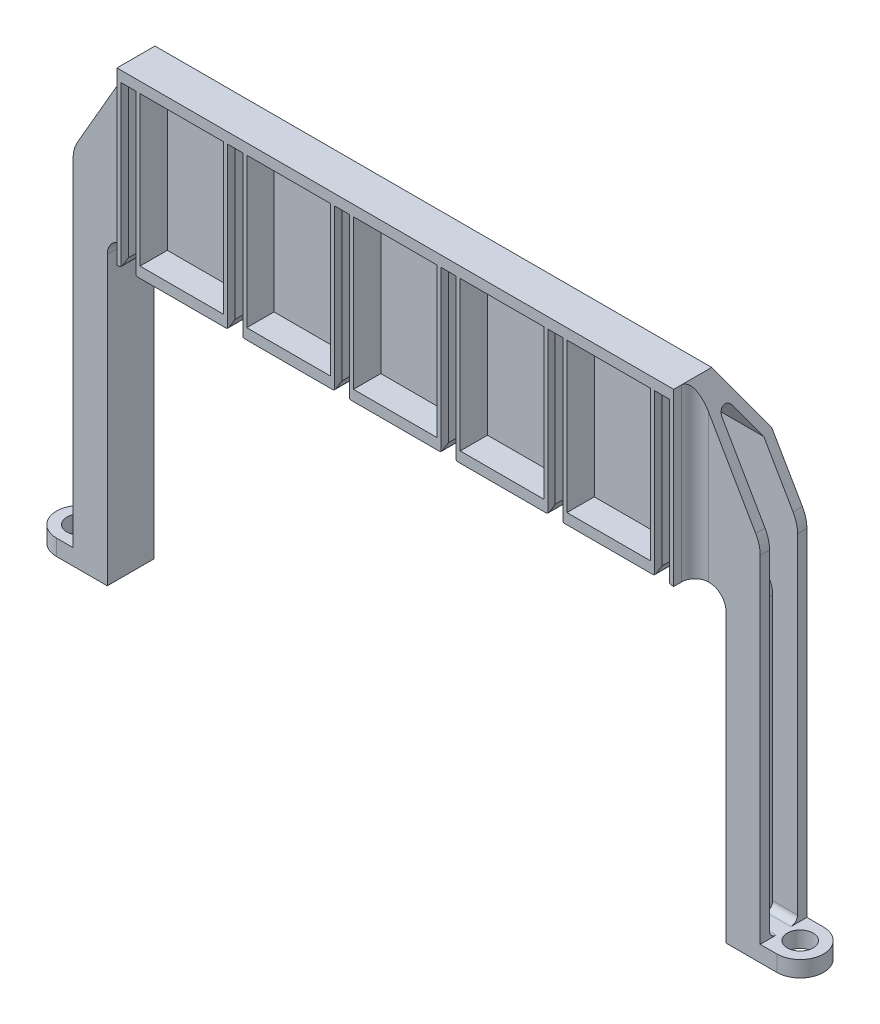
SolidWorks part; units mm, degrees
ref_plane "Front Plane" through (0, 0, 0) normal (0, 0, 1) x (1, 0, 0)
ref_plane "Top Plane" through (0, 0, 0) normal (0, 1, 0) x (1, 0, 0)
ref_plane "Right Plane" through (0, 0, 0) normal (1, 0, 0) x (0, 0, -1)
sketch "Sketch1" plane through (0, 0, 0) normal (0, 1, 0) x (1, 0, 0)
  line L0 (-0.9207, 0) -> (0.9207, 0)
  line L1 (-0.9207, 0) -> (-0.9207, -2.54)
  line L2 (-2.1907, -3.4199) -> (-1.4287, -3.4199)
  line L3 (-2.1907, -3.4199) -> (-2.1908, 3.81)
  line L4 (-2.1908, 3.81) -> (2.1907, 3.81)
  line L5 (0.9207, 0) -> (0.9208, -2.54)
  line L6 (0, 0) -> (0, -8.1054) construction
  line L7 (-1.4287, -3.4199) -> (-0.9207, -2.54)
  line L8 (2.1907, -3.4199) -> (2.1907, 3.81)
  line L9 (2.1907, -3.4199) -> (1.4287, -3.4199)
  line L10 (1.4287, -3.4199) -> (0.9208, -2.54)
  dimension "D1" = 1.8415
  dimension "D2" = 3.81
  dimension "D3" = 2.54
  dimension "D4" = 60
  dimension "D5" = 0.762
  dimension "D6" = 1.27
extrude "Boss-Extrude1" add sketch "Sketch1" against normal blind 30.48
chamfer "Chamfer1" distance 0.508 angle 70 2 edges at (-0.9207, -30.48, 1.27) (0.9208, -30.48, 1.27)
fillet "Fillet4" radius 0.508 3 edges at (1.4288, -30.48, 1.7099) (-1.4288, -30.48, 1.7099) (0, -30.48, 0)
pattern_linear "LPattern3" count 6 spacing 20.32 along (-1, 0, 0)
ref_plane "Plane2" through (-50.8, 0, 0) normal (-1, 0, 0) x (0, 0, 1)
sketch "Sketch3" plane through (0, 0, 0) normal (0, 1, 0) x (1, 0, 0)
  line L1 (2.1907, 3.81) -> (-103.7908, 3.81)
  line L2 (2.1907, 3.81) -> (2.1907, -3.4199)
  line L3 (2.1907, -3.4199) -> (-103.7908, -3.4199)
  line L4 (-103.7908, 3.81) -> (-103.7908, -3.4199)
extrude "Boss-Extrude3" add sketch "Sketch3" along normal blind 2.032
ref_plane "Plane4" through (0, -4.318, 0) normal (0, 1, 0) x (1, 0, 0)
sketch "Sketch7" plane through (0, 2.032, 0) normal (0, 1, 0) x (1, 0, 0)
  line L0 (-2.1908, 3.81) -> (-2.1907, -3.4199) construction
  line L1 (-2.1908, 9.525) -> (17.778, 9.525)
  line L2 (17.778, 0.635) -> (2.1907, 0.635)
  line L3 (25.398, -172.7825) -> (25.398, 30.4175) construction
  line L4 (2.1907, 3.81) -> (-103.7908, 3.81) construction
  line L5 (-2.1908, 9.525) -> (-2.1907, 3.81)
  line L6 (-2.1907, 3.81) -> (2.1907, 3.81)
  line L7 (2.1907, 3.81) -> (2.1907, 0.635)
  line L11 (2.1907, -3.4199) -> (2.1907, 3.81) construction
  arc A1 (17.778, 9.525) -> (17.778, 0.635) centre (17.778, 5.08) cw
  dimension "D2" = 7.62
  dimension "D1" = 4.445
  dimension "D3" = 1.27
extrude "Boss-Extrude6" add sketch "Sketch7" against normal up to surface (90.372 mm away)
sketch "Sketch34" plane through (0, 0, -9.525) normal (0, 0, -1) x (-1, 0, 0)
  line L1 (2.1908, -30.48) -> (-4.9213, -30.48)
  line L2 (-8.0963, -33.655) -> (-8.0962, -88.34)
  line L3 (-17.778, -88.34) -> (2.1908, -88.34) construction
  line L4 (-8.0962, -88.34) -> (2.1908, -88.34)
  line L5 (2.1908, -88.34) -> (2.1908, -30.48)
  line L6 (-2.1908, 2.032) -> (-14.603, -19.4666)
  line L10 (-14.603, -19.4666) -> (-14.603, -85.292)
  line L11 (-2.1907, -30.48) -> (2.1907, -30.48) construction
  line L12 (-17.778, 2.032) -> (2.1908, 2.032) construction
  line L13 (-14.603, -85.292) -> (-22.223, -85.292)
  line L15 (-22.223, -85.292) -> (-22.223, 2.032)
  line L18 (-22.223, 2.032) -> (-2.1908, 2.032)
  line L19 (-22.223, 2.032) -> (-22.223, -88.34) construction
  line L20 (-17.778, -88.34) -> (2.1908, -88.34) construction
  arc A0 (-8.0963, -33.655) -> (-4.9213, -30.48) centre (-4.9213, -33.655) cw
  point P5 (-9.2392, -30.48)
  dimension "D2" = 7.62
  dimension "D1" = 3.175
  dimension "D4" = 60
  dimension "D5" = 3.048
  dimension "D7" = 7.112
extrude "Cut-Extrude14" cut sketch "Sketch34" against normal up to surface (8.89 mm away)
sketch "Sketch35" plane through (-2.1907, 0, 0) normal (-1, 0, 0) x (0, 0, 1)
  line L0 (-3.81, 2.032) -> (-9.525, -7.8667)
  line L1 (-9.525, -30.48) -> (-9.525, 2.032) construction
  line L2 (-9.525, -7.8667) -> (-9.525, 2.032)
  line L3 (-9.525, 2.032) -> (-3.81, 2.032)
  dimension "D1" = 60
extrude "Cut-Extrude18" cut sketch "Sketch35" against normal through all
sketch "Sketch36" plane through (0, 2.032, 0) normal (0, 1, 0) x (1, 0, 0)
  line L1 (-0.4128, 7.747) -> (29.1222, 7.747)
  line L2 (-0.4128, 7.747) -> (-0.4128, 2.413)
  line L3 (-0.4128, 2.413) -> (29.1222, 2.413)
  line L4 (29.1222, 7.747) -> (29.1222, 2.413)
  line L5 (22.223, 5.08) -> (-0.4128, 5.08) construction
  line L6 (7.9058, 9.525) -> (-2.1908, 9.525) construction
  line L7 (-2.1908, 9.525) -> (-2.1908, 3.81) construction
  arc A0 (17.778, 0.635) -> (17.778, 9.525) centre (17.778, 5.08) ccw construction
  dimension "D1" = 1.778
  dimension "D2" = 1.778
extrude "Cut-Extrude19" cut sketch "Sketch36" against normal up to surface (87.324 mm away)
sketch "Sketch37" plane through (0, 0, -7.747) normal (0, 0, 1) x (1, 0, 0)
  line L11 (-2.1907, -28.702) -> (4.9213, -28.702)
  line L12 (9.8742, -33.655) -> (9.8743, -88.3029)
  line L13 (-2.1907, -30.48) -> (4.9213, -30.48)
  line L14 (8.0962, -33.655) -> (8.0962, -88.34)
  line L15 (-2.1907, -30.48) -> (4.9213, -30.48)
  line L16 (8.0962, -33.655) -> (8.0962, -88.34)
  line L17 (-2.1907, -30.48) -> (-2.1907, -28.702)
  line L18 (8.0962, -88.34) -> (11.0176, -88.34)
  line L19 (25.398, -88.34) -> (-127.002, -88.34) construction
  line L20 (11.0176, -88.34) -> (9.8743, -88.3029)
  arc A3 (9.8742, -33.655) -> (4.9213, -28.702) centre (4.9213, -33.655) ccw
  arc A4 (8.0962, -33.655) -> (4.9213, -30.48) centre (4.9213, -33.655) ccw
  arc A5 (8.0962, -33.655) -> (4.9213, -30.48) centre (4.9213, -33.655) ccw
  dimension "D4" = 1.778
  dimension "D2" = 1.778
  dimension "D3" = 1.778
  dimension "D1" = 0
extrude "Boss-Extrude7" add sketch "Sketch37" along normal up to surface (5.334 mm away)
sketch "Sketch39" plane through (-0.4128, 0, 0) normal (-1, 0, 0) x (0, 0, 1)
  line L0 (-2.413, 2.032) -> (-2.413, 0.8957)
  line L1 (-2.413, -28.702) -> (-2.413, 2.032) construction
  line L2 (-2.413, 0.8957) -> (-7.747, -8.3431)
  line L3 (-7.747, -28.702) -> (-7.747, -4.7871) construction
  line L4 (-7.747, -8.3431) -> (-7.747, -4.7871)
  line L5 (-2.413, -28.702) -> (-2.413, 2.032) construction
  line L6 (-2.413, 2.032) -> (-3.81, 2.032)
  line L7 (-3.81, 2.032) -> (-7.747, -4.7871)
  dimension "D1" = 1.778
extrude "Boss-Extrude9" add sketch "Sketch39" against normal up to surface (3.2596 mm away)
hole_wizard "#10 (0.1935) Diameter Hole1" positions "Sketch41" profile "Sketch40" hole size "#10" standard "ANSI Inch"
sketch "Sketch41" plane through (0, -85.292, 0) normal (0, 1, 0) x (1, 0, 0)
  arc A0 (17.778, 0.635) -> (17.778, 9.525) centre (17.778, 5.08) ccw construction
  point P0 (17.778, 5.08)
sketch "Sketch40" plane through (17.778, -85.292, -5.08) normal (1, 0, 0) x (0, 0, 1)
  line L0 (0, 0) -> (0, 3.048)
  line L1 (0, 3.048) -> (2.4574, 3.048)
  line L2 (2.4574, 3.048) -> (2.4574, 0)
  line L5 (2.4574, 0) -> (0, 0)
  line L11 (0, -6.35) -> (0, 107.95) construction
  dimension "Thru Hole Dia." = 4.9149
  dimension "Thru Hole Depth" = 3.048
mirror "Mirror1" about plane through (-50.8, 0, 0) normal (-1, 0, 0) of "#10 (0.1935) Diameter Hole1", "Boss-Extrude9", "Boss-Extrude7", "Cut-Extrude19", "Cut-Extrude18", "Cut-Extrude14", "Boss-Extrude6"
sketch "Sketch43" plane through (0, -30.48, 0) normal (0, -1, 0) x (1, 0, 0)
  line L0 (-63.1508, -3.81) -> (-79.0892, -3.81) construction
  line L1 (-18.1292, 3.4199) -> (-2.1908, 3.4199)
  line L2 (-18.1292, 3.4199) -> (-18.1293, -3.81)
  line L3 (-18.1293, -3.81) -> (-2.1907, -9.525)
  line L4 (-2.1908, 3.4199) -> (-2.1907, -9.525)
  line L5 (-38.4493, 3.4199) -> (-22.5108, 3.4199)
  line L6 (-38.4493, 3.4199) -> (-38.4493, -3.81)
  line L7 (-38.4493, -3.81) -> (-22.5108, -3.81)
  line L8 (-22.5108, 3.4199) -> (-22.5108, -3.81)
  line L9 (-58.7692, 3.4199) -> (-42.8308, 3.4199)
  line L10 (-58.7692, 3.4199) -> (-58.7692, -3.81)
  line L11 (-58.7692, -3.81) -> (-42.8308, -3.81)
  line L12 (-42.8308, 3.4199) -> (-42.8308, -3.81)
  line L13 (-99.4093, 3.4199) -> (-83.4708, 3.4199)
  line L14 (-99.4093, 3.4199) -> (-99.4093, -9.525)
  line L15 (-99.4093, -9.525) -> (-83.4708, -3.81)
  line L16 (-83.4708, 3.4199) -> (-83.4708, -3.81)
  line L17 (-79.0892, 3.4199) -> (-63.1508, 3.4199)
  line L18 (-79.0892, 3.4199) -> (-79.0892, -3.81)
  line L19 (-79.0892, -3.81) -> (-63.1508, -3.81)
  line L20 (-63.1508, 3.4199) -> (-63.1508, -3.81)
extrude "Boss-Extrude11" add sketch "Sketch43" against normal blind 2.032
sketch "Sketch44" plane through (-99.4093, 0, 0) normal (1, 0, 0) x (0, 0, -1)
  line L0 (-3.4199, -28.448) -> (9.525, -28.448) construction
  line L1 (3.81, 0) -> (1.778, 0)
  line L2 (3.81, 0) -> (3.81, -28.448)
  line L3 (3.81, -28.448) -> (1.778, -28.448)
  line L4 (1.778, 0) -> (1.778, -28.448)
  dimension "D1" = 2.032
extrude "Boss-Extrude12" add sketch "Sketch44" along normal up to surface (97.2185 mm away)
fillet "Fillet1" radius 2.54 4 edges at (2.1907, -14.224, -0.635) (-99.4093, -13.208, -3.81) (-103.7908, -14.224, -0.635)
fillet "Fillet2" radius 1.27 8 edges at (-102.817, 0.8957, -2.413) (1.217, 0.8957, -2.413) (-113.8386, -85.292, -7.747) (-113.8386, -85.292, -2.413) (12.2386, -85.292, -7.747) (12.2386, -85.292, -2.413) (-0.4128, -28.702, -5.08) (-101.1873, -28.702, -5.08)
fillet "Fillet3" radius 6.35 4 edges at (14.603, -19.4666, -8.636) (14.603, -19.4666, -1.524) (-116.203, -19.4666, -8.636) (-116.203, -19.4666, -1.524)
sketch "Sketch45" plane through (0, 0, -9.525) normal (0, 0, -1) x (-1, 0, 0)
  line L0 (99.4093, -28.448) -> (99.4093, -7.8667) construction
  line L1 (2.1908, -7.8667) -> (99.4093, -7.8667)
  line L2 (2.1908, -7.8667) -> (2.1908, -11.6767)
  line L3 (2.1908, -11.6767) -> (99.4093, -11.6767)
  line L4 (99.4093, -7.8667) -> (99.4093, -11.6767)
  dimension "D1" = 3.81
extrude "Boss-Extrude13" add sketch "Sketch45" against normal up to surface (5.715 mm away)
